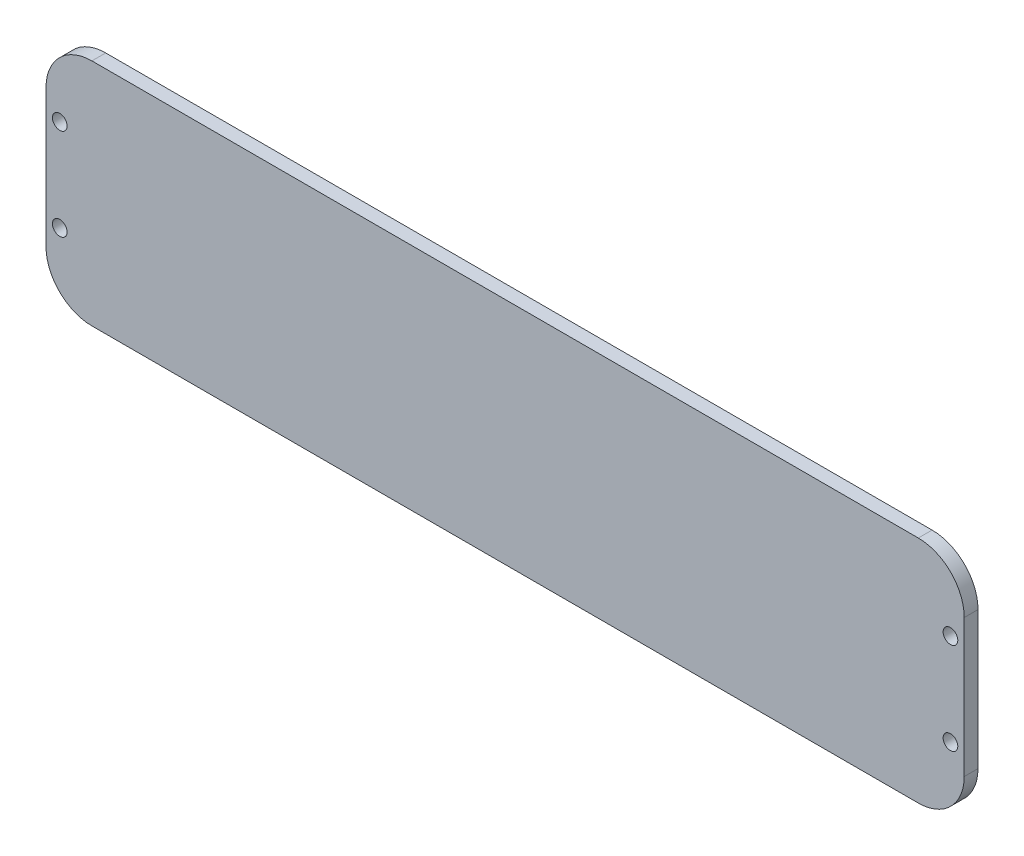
SolidWorks part; units mm, degrees
ref_plane "前视基准面" through (0, 0, 0) normal (0, 0, 1) x (1, 0, 0)
ref_plane "上视基准面" through (0, 0, 0) normal (0, 1, 0) x (1, 0, 0)
ref_plane "右视基准面" through (0, 0, 0) normal (1, 0, 0) x (0, 0, -1)
sketch "草图1" plane through (0, 0, 0) normal (0, 0, 1) x (1, 0, 0)
  line L0 (0, 0) -> (0, 33.5363) construction
  line L1 (-100, -25) -> (100, -25)
  line L2 (-100, -25) -> (-100, 25)
  line L3 (-100, 25) -> (100, 25)
  line L4 (100, -25) -> (100, 25)
  line L5 (-100, -25) -> (100, 25) construction
  line L6 (-100, 25) -> (100, -25) construction
  circle A0 centre (-97, 10) radius 1.6
  circle A1 centre (-97, -10) radius 1.6
  circle A2 centre (97, -10) radius 1.6
  circle A3 centre (97, 10) radius 1.6
  point P0 (0, 0)
  dimension "D3" = 20
  dimension "D4" = 10
  dimension "D5" = 3.2
  dimension "D6" = 3.2
  dimension "D7" = 3
  dimension "D8" = 3
  dimension "D1" = 200
  dimension "D2" = 50
extrude "凸台-拉伸1" add sketch "草图1" along normal blind 3
fillet "圆角1" radius 10 4 edges at (100, -25, 1.5) (-100, -25, 1.5) (-100, 25, 1.5) (100, 25, 1.5)
